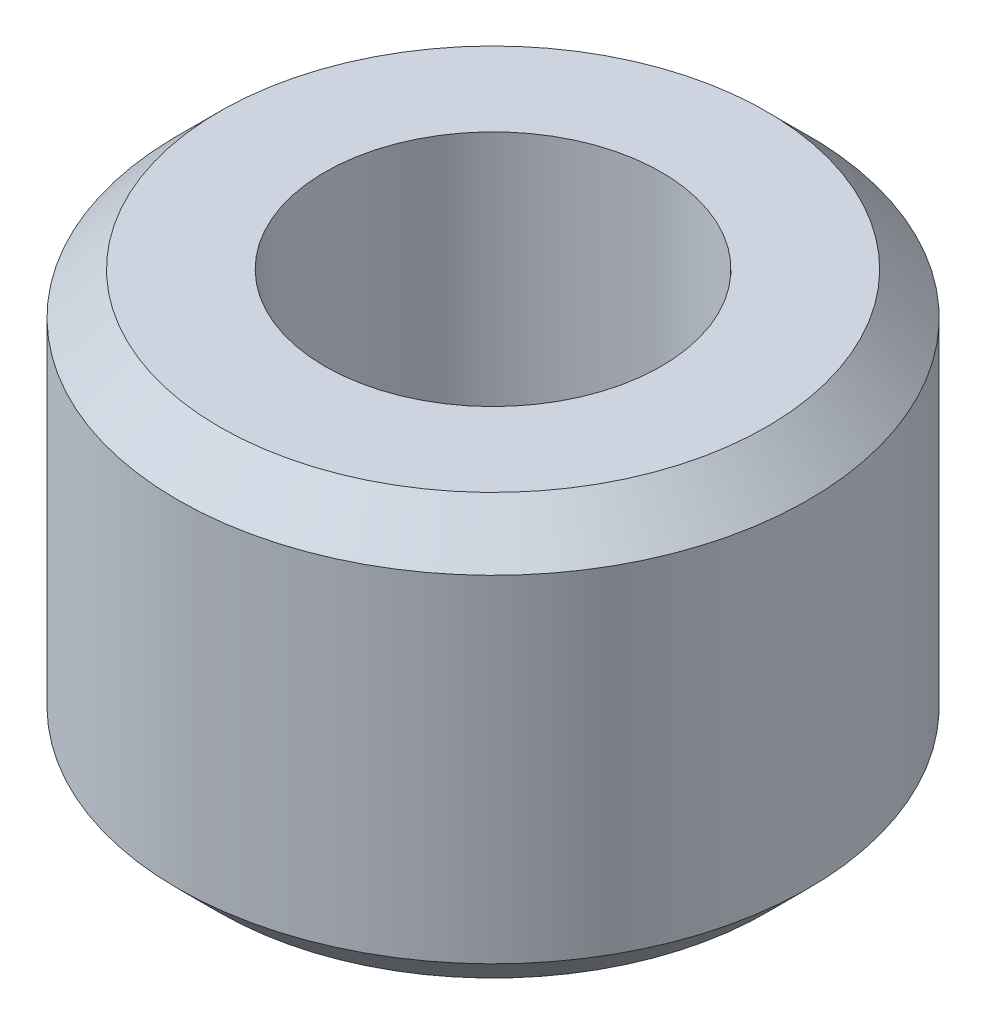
SolidWorks part; units mm, degrees
ref_plane "Front Plane" through (0, 0, 0) normal (0, 0, 1) x (1, 0, 0)
ref_plane "Top Plane" through (0, 0, 0) normal (0, 1, 0) x (1, 0, 0)
ref_plane "Right Plane" through (0, 0, 0) normal (1, 0, 0) x (0, 0, -1)
sketch "Sketch1" plane through (0, 0, 0) normal (0, 1, 0) x (1, 0, 0)
  circle A0 centre (0, 0) radius 4
  circle A1 centre (0, 0) radius 7.5
  dimension "D1" = 8
  dimension "D2" = 15
extrude "Boss-Extrude1" add sketch "Sketch1" along normal blind 10
chamfer "Chamfer1" distance 1 angle 45 2 edges at (0, 0, 7.5) (0, 10, 7.5)
